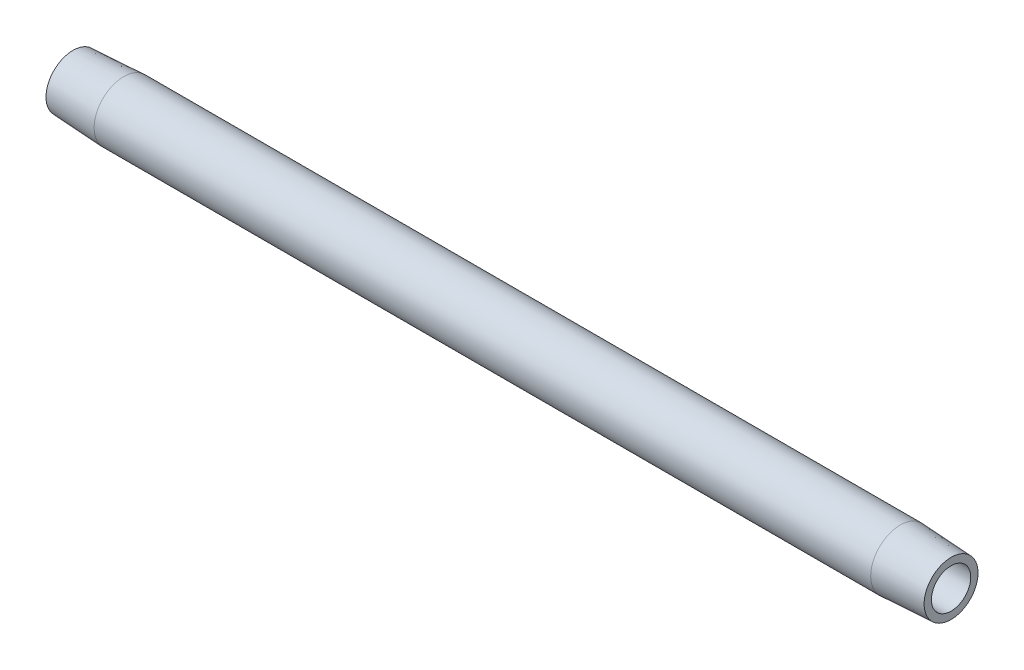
SolidWorks part; units mm, degrees
ref_plane "Front Plane" through (0, 0, 0) normal (0, 0, 1) x (1, 0, 0)
ref_plane "Top Plane" through (0, 0, 0) normal (0, 1, 0) x (1, 0, 0)
ref_plane "Right Plane" through (0, 0, 0) normal (1, 0, 0) x (0, 0, -1)
sketch "Sketch2" plane through (0, 0, 0) normal (0, 0, 1) x (1, 0, 0)
  line L0 (0.4761, 0) -> (50000.4761, 0) construction
  line L1 (0, -11.3625) -> (0, 49988.6375) construction
  line L7 (8.81, 5.1435) -> (0, 4.6818)
  line L8 (143.59, 5.1435) -> (8.81, 5.1435)
  line L9 (152.4, 4.6818) -> (143.59, 5.1435)
  line L10 (152.4, 3.4163) -> (152.4, 4.6818)
  line L11 (152.4, 3.4163) -> (0, 3.4163)
  line L12 (0, 4.6818) -> (0, 3.4163)
  dimension "D1" = 6.8326
  dimension "D2" = 10.287
  dimension "D3" = 3
  dimension "D4" = 3
  dimension "D5" = 8.81
  dimension "D6" = 8.81
  dimension "D7" = 152.4
revolve "Revolve1" add sketch "Sketch2" angle 360 about L0
